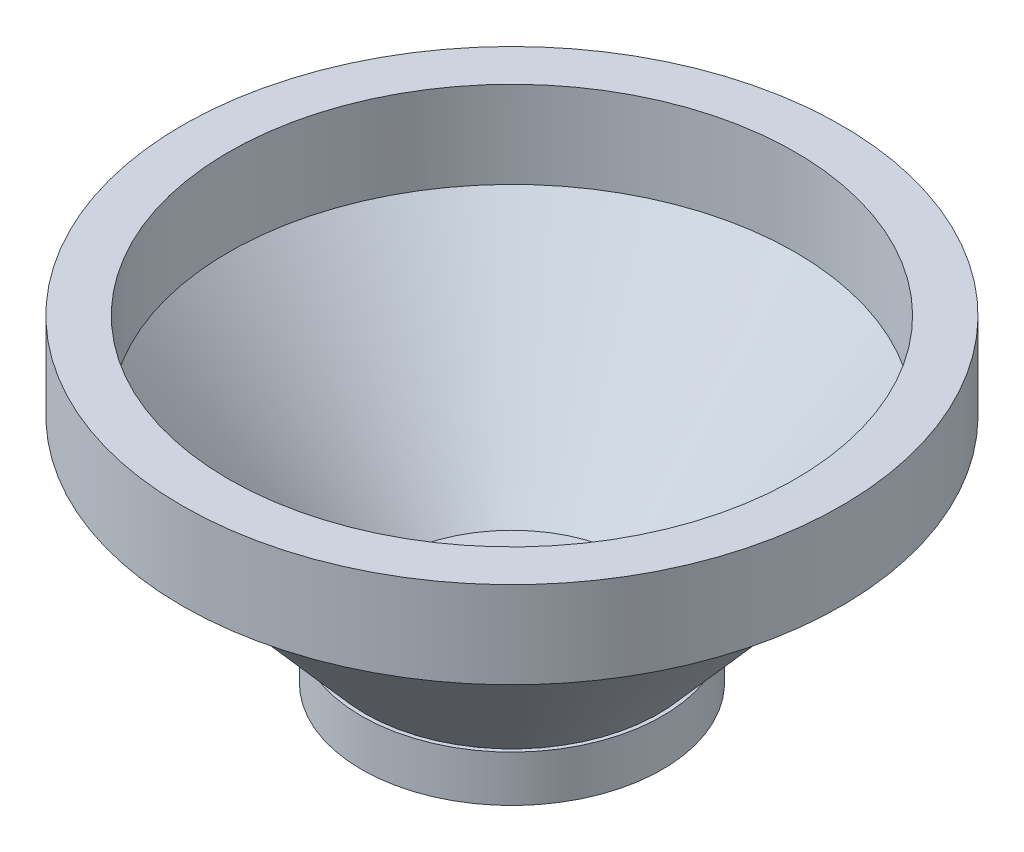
SolidWorks part; units mm, degrees
ref_plane "Front Plane" through (0, 0, 0) normal (0, 0, 1) x (1, 0, 0)
ref_plane "Top Plane" through (0, 0, 0) normal (0, 1, 0) x (1, 0, 0)
ref_plane "Right Plane" through (0, 0, 0) normal (1, 0, 0) x (0, 0, -1)
sketch "Sketch1" plane through (0, 0, 0) normal (0, 1, 0) x (1, 0, 0)
  circle A0 centre (0, 0) radius 12.8984
  circle A3 centre (0, 0) radius 20.6375
  dimension "D1" = 25.7969
  dimension "D2" = 41.275
extrude "Boss-Extrude1" add sketch "Sketch1" along normal blind 6.35
sketch "Sketch2" plane through (0, 6.35, 0) normal (0, 1, 0) x (1, 0, 0)
  circle A0 centre (0, 0) radius 16.6687
  dimension "D1" = 33.3375
ref_plane "Plane1" through (0, 31.75, 0) normal (0, 1, 0) x (1, 0, 0)
sketch "Sketch3" plane through (0, 31.75, 0) normal (0, 1, 0) x (1, 0, 0)
  circle A0 centre (0, 0) radius 38.8938
  dimension "D1" = 77.7875
loft "10ga AL" add profiles "Sketch3", "Sketch2" parameters "D1"=2.5883
sketch "Sketch4" plane through (0, 31.75, 0) normal (0, 1, 0) x (1, 0, 0)
  circle A0 centre (0, 0) radius 38.8938
  circle A1 centre (0, 0) radius 38.8938 construction
  circle A2 centre (0, 0) radius 45.2438
  dimension "D1" = 6.35
extrude "Boss-Extrude2" add sketch "Sketch4" along normal blind 11.9062
